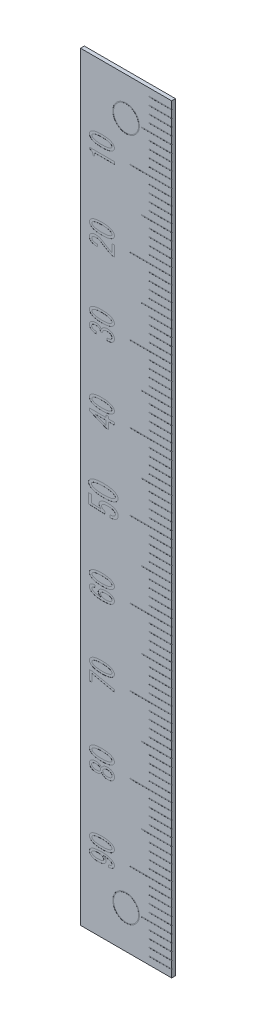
SolidWorks part; units mm, degrees
ref_plane "Front" through (0, 0, 0) normal (0, 0, 1) x (1, 0, 0)
ref_plane "Top" through (0, 0, 0) normal (0, 1, 0) x (1, 0, 0)
ref_plane "Right" through (0, 0, 0) normal (1, 0, 0) x (0, 0, -1)
sketch "Sketch1" plane through (0, 0, 0) normal (0, 0, 1) x (1, 0, 0)
  line L1 (0, 0) -> (0, 100)
  line L2 (0, 0) -> (12, 0)
  line L3 (12, 0) -> (12, 100)
  line L4 (0, 100) -> (12, 100)
  dimension "D1" = 100
  dimension "D2" = 12
extrude "Extrude1" add sketch "Sketch1" along normal blind 0.5
sketch "Sketch2" plane through (0, 0, 0.5) normal (0, 0, 1) x (1, 0, 0)
  line L0 (0, 100) -> (0, 0) construction
  line L1 (0, 0) -> (12, 0) construction
  line L2 (12, 100) -> (0, 100) construction
  circle A0 centre (6, 5) radius 1.75
  circle A1 centre (6, 95) radius 1.75
  circle A2 centre (6, 5) radius 1.65
  circle A3 centre (6, 95) radius 1.65
  dimension "D1" = 6
  dimension "D2" = 6
  dimension "D3" = 5
  dimension "D4" = 5
  dimension "D5" = 3.5
  dimension "D6" = 3.5
  dimension "D7" = 0.1
extrude "Extrude2" cut sketch "Sketch2" against normal blind 0.01
sketch "Sketch3" plane through (0, 0, 0.5) normal (0, 0, 1) x (1, 0, 0)
  line L0 (12, 100) -> (0, 100) construction
  line L1 (1, 88.25) -> (4.5, 88.25) construction
  line L2 (1, 88.25) -> (1, 91.75) construction
  line L3 (1, 91.75) -> (4.5, 91.75) construction
  line L4 (4.5, 88.25) -> (4.5, 91.75) construction
  line L5 (0, 100) -> (0, 0) construction
  line L6 (4.5, 78.25) -> (4.5, 81.75) construction
  line L7 (4.5, 68.25) -> (4.5, 71.75) construction
  line L8 (4.5, 58.25) -> (4.5, 61.75) construction
  line L9 (5, 48.25) -> (5, 51.75) construction
  line L10 (4.5, 38.25) -> (4.5, 41.75) construction
  line L11 (4.5, 28.25) -> (4.5, 31.75) construction
  line L12 (4.5, 18.25) -> (4.5, 21.75) construction
  line L13 (4.5, 8.25) -> (4.5, 11.75) construction
  line L14 (12, 0) -> (12, 100) construction
  text T0 "10" font "ＭＳ ゴシック" height in points 11
  text T1 "20" font "ＭＳ ゴシック" height in points 11
  text T2 "30" font "ＭＳ ゴシック" height in points 11
  text T3 "40" font "ＭＳ ゴシック" height in points 11
  text T4 "50" font "ＭＳ ゴシック" height in points 13
  text T5 "60  " font "ＭＳ ゴシック" height in points 11
  text T6 "70" font "ＭＳ ゴシック" height in points 11
  text T7 "80" font "ＭＳ ゴシック" height in points 11
  text T8 "90" font "ＭＳ ゴシック" height in points 11
  point P4 (4.5, 90)
  point P34 (5, 50)
  dimension "D1" = 3.5
  dimension "D2" = 10
  dimension "D3" = 1
  dimension "D4" = 3.5
  dimension "D7" = 7
  dimension "D5" = 4
extrude "Extrude3" cut sketch "Sketch3" against normal blind 0.01
sketch "Sketch4" plane through (0, 0, 0.5) normal (0, 0, 1) x (1, 0, 0)
  line L0 (12, 90.05) -> (6.5, 90.05)
  line L1 (12, 0) -> (12, 100) construction
  line L2 (6.5, 90.05) -> (6.5, 89.95)
  line L3 (6.5, 89.95) -> (12, 89.95)
  line L4 (12, 89.95) -> (12, 90.05)
  line L5 (12, 100) -> (0, 100) construction
  line L6 (12, 98.05) -> (12, 97.95)
  line L7 (12, 94.95) -> (8, 94.95)
  line L8 (12, 94.95) -> (12, 95.05)
  line L9 (12, 95.05) -> (8, 95.05)
  line L10 (8, 94.95) -> (8, 95.05)
  line L11 (12, 99.05) -> (9, 99.05)
  line L12 (12, 99.05) -> (12, 98.95)
  line L13 (12, 98.95) -> (9, 98.95)
  line L14 (9, 99.05) -> (9, 98.95)
  line L15 (12, 98.05) -> (9, 98.05)
  line L16 (12, 97.95) -> (9, 97.95)
  line L17 (9, 98.05) -> (9, 97.95)
  line L18 (12, 97.05) -> (12, 96.95)
  line L19 (12, 97.05) -> (9, 97.05)
  line L20 (12, 96.95) -> (9, 96.95)
  line L21 (9, 97.05) -> (9, 96.95)
  line L22 (12, 96.05) -> (12, 95.95)
  line L23 (12, 96.05) -> (9, 96.05)
  line L24 (12, 95.95) -> (9, 95.95)
  line L25 (9, 96.05) -> (9, 95.95)
  line L26 (12, 80.05) -> (6.5, 80.05)
  line L27 (6.5, 80.05) -> (6.5, 79.95)
  line L28 (6.5, 79.95) -> (12, 79.95)
  line L29 (12, 79.95) -> (12, 80.05)
  line L30 (12, 94.05) -> (12, 93.95)
  line L31 (12, 94.05) -> (9, 94.05)
  line L32 (12, 93.95) -> (9, 93.95)
  line L33 (9, 94.05) -> (9, 93.95)
  line L34 (12, 93.05) -> (12, 92.95)
  line L35 (12, 93.05) -> (9, 93.05)
  line L36 (12, 92.95) -> (9, 92.95)
  line L37 (9, 93.05) -> (9, 92.95)
  line L38 (12, 92.05) -> (12, 91.95)
  line L39 (12, 92.05) -> (9, 92.05)
  line L40 (12, 91.95) -> (9, 91.95)
  line L41 (9, 92.05) -> (9, 91.95)
  line L42 (12, 91.05) -> (12, 90.95)
  line L43 (12, 91.05) -> (9, 91.05)
  line L44 (12, 90.95) -> (9, 90.95)
  line L45 (9, 91.05) -> (9, 90.95)
  line L46 (9, 95.05) -> (9, 94.95)
  line L47 (12, 95.05) -> (9, 95.05)
  line L48 (12, 94.95) -> (9, 94.95)
  line L49 (12, 95.05) -> (12, 94.95)
  line L50 (12, 88.05) -> (12, 87.95)
  line L51 (12, 84.95) -> (8, 84.95)
  line L52 (12, 84.95) -> (12, 85.05)
  line L53 (12, 85.05) -> (8, 85.05)
  line L54 (8, 84.95) -> (8, 85.05)
  line L55 (12, 89.05) -> (9, 89.05)
  line L56 (12, 89.05) -> (12, 88.95)
  line L57 (12, 88.95) -> (9, 88.95)
  line L58 (9, 89.05) -> (9, 88.95)
  line L59 (12, 88.05) -> (9, 88.05)
  line L60 (12, 87.95) -> (9, 87.95)
  line L61 (9, 88.05) -> (9, 87.95)
  line L62 (12, 87.05) -> (12, 86.95)
  line L63 (12, 87.05) -> (9, 87.05)
  line L64 (12, 86.95) -> (9, 86.95)
  line L65 (9, 87.05) -> (9, 86.95)
  line L66 (12, 86.05) -> (12, 85.95)
  line L67 (12, 86.05) -> (9, 86.05)
  line L68 (12, 85.95) -> (9, 85.95)
  line L69 (9, 86.05) -> (9, 85.95)
  line L70 (12, 84.05) -> (12, 83.95)
  line L71 (12, 84.05) -> (9, 84.05)
  line L72 (12, 83.95) -> (9, 83.95)
  line L73 (9, 84.05) -> (9, 83.95)
  line L74 (12, 83.05) -> (12, 82.95)
  line L75 (12, 83.05) -> (9, 83.05)
  line L76 (12, 82.95) -> (9, 82.95)
  line L77 (9, 83.05) -> (9, 82.95)
  line L78 (12, 82.05) -> (12, 81.95)
  line L79 (12, 82.05) -> (9, 82.05)
  line L80 (12, 81.95) -> (9, 81.95)
  line L81 (9, 82.05) -> (9, 81.95)
  line L82 (12, 81.05) -> (12, 80.95)
  line L83 (12, 81.05) -> (9, 81.05)
  line L84 (12, 80.95) -> (9, 80.95)
  line L85 (9, 81.05) -> (9, 80.95)
  line L86 (12, 70.05) -> (6.5, 70.05)
  line L87 (6.5, 70.05) -> (6.5, 69.95)
  line L88 (6.5, 69.95) -> (12, 69.95)
  line L89 (12, 69.95) -> (12, 70.05)
  line L90 (12, 78.05) -> (12, 77.95)
  line L91 (12, 74.95) -> (8, 74.95)
  line L92 (12, 74.95) -> (12, 75.05)
  line L93 (12, 75.05) -> (8, 75.05)
  line L94 (8, 74.95) -> (8, 75.05)
  line L95 (12, 79.05) -> (9, 79.05)
  line L96 (12, 79.05) -> (12, 78.95)
  line L97 (12, 78.95) -> (9, 78.95)
  line L98 (9, 79.05) -> (9, 78.95)
  line L99 (12, 78.05) -> (9, 78.05)
  line L100 (12, 77.95) -> (9, 77.95)
  line L101 (9, 78.05) -> (9, 77.95)
  line L102 (12, 77.05) -> (12, 76.95)
  line L103 (12, 77.05) -> (9, 77.05)
  line L104 (12, 76.95) -> (9, 76.95)
  line L105 (9, 77.05) -> (9, 76.95)
  line L106 (12, 76.05) -> (12, 75.95)
  line L107 (12, 76.05) -> (9, 76.05)
  line L108 (12, 75.95) -> (9, 75.95)
  line L109 (9, 76.05) -> (9, 75.95)
  line L110 (12, 74.05) -> (12, 73.95)
  line L111 (12, 74.05) -> (9, 74.05)
  line L112 (12, 73.95) -> (9, 73.95)
  line L113 (9, 74.05) -> (9, 73.95)
  line L114 (12, 73.05) -> (12, 72.95)
  line L115 (12, 73.05) -> (9, 73.05)
  line L116 (12, 72.95) -> (9, 72.95)
  line L117 (9, 73.05) -> (9, 72.95)
  line L118 (12, 72.05) -> (12, 71.95)
  line L119 (12, 72.05) -> (9, 72.05)
  line L120 (12, 71.95) -> (9, 71.95)
  line L121 (9, 72.05) -> (9, 71.95)
  line L122 (12, 71.05) -> (12, 70.95)
  line L123 (12, 71.05) -> (9, 71.05)
  line L124 (12, 70.95) -> (9, 70.95)
  line L125 (9, 71.05) -> (9, 70.95)
  line L126 (12, 60.05) -> (6.5, 60.05)
  line L127 (6.5, 60.05) -> (6.5, 59.95)
  line L128 (6.5, 59.95) -> (12, 59.95)
  line L129 (12, 59.95) -> (12, 60.05)
  line L130 (12, 68.05) -> (12, 67.95)
  line L131 (12, 64.95) -> (8, 64.95)
  line L132 (12, 64.95) -> (12, 65.05)
  line L133 (12, 65.05) -> (8, 65.05)
  line L134 (8, 64.95) -> (8, 65.05)
  line L135 (12, 69.05) -> (9, 69.05)
  line L136 (12, 69.05) -> (12, 68.95)
  line L137 (12, 68.95) -> (9, 68.95)
  line L138 (9, 69.05) -> (9, 68.95)
  line L139 (12, 68.05) -> (9, 68.05)
  line L140 (12, 67.95) -> (9, 67.95)
  line L141 (9, 68.05) -> (9, 67.95)
  line L142 (12, 67.05) -> (12, 66.95)
  line L143 (12, 67.05) -> (9, 67.05)
  line L144 (12, 66.95) -> (9, 66.95)
  line L145 (9, 67.05) -> (9, 66.95)
  line L146 (12, 66.05) -> (12, 65.95)
  line L147 (12, 66.05) -> (9, 66.05)
  line L148 (12, 65.95) -> (9, 65.95)
  line L149 (9, 66.05) -> (9, 65.95)
  line L150 (12, 64.05) -> (12, 63.95)
  line L151 (12, 64.05) -> (9, 64.05)
  line L152 (12, 63.95) -> (9, 63.95)
  line L153 (9, 64.05) -> (9, 63.95)
  line L154 (12, 63.05) -> (12, 62.95)
  line L155 (12, 63.05) -> (9, 63.05)
  line L156 (12, 62.95) -> (9, 62.95)
  line L157 (9, 63.05) -> (9, 62.95)
  line L158 (12, 62.05) -> (12, 61.95)
  line L159 (12, 62.05) -> (9, 62.05)
  line L160 (12, 61.95) -> (9, 61.95)
  line L161 (9, 62.05) -> (9, 61.95)
  line L162 (12, 61.05) -> (12, 60.95)
  line L163 (12, 61.05) -> (9, 61.05)
  line L164 (12, 60.95) -> (9, 60.95)
  line L165 (9, 61.05) -> (9, 60.95)
  line L166 (12, 50.05) -> (6.5, 50.05)
  line L167 (6.5, 50.05) -> (6.5, 49.95)
  line L168 (6.5, 49.95) -> (12, 49.95)
  line L169 (12, 49.95) -> (12, 50.05)
  line L170 (12, 58.05) -> (12, 57.95)
  line L171 (12, 54.95) -> (8, 54.95)
  line L172 (12, 54.95) -> (12, 55.05)
  line L173 (12, 55.05) -> (8, 55.05)
  line L174 (8, 54.95) -> (8, 55.05)
  line L175 (12, 59.05) -> (9, 59.05)
  line L176 (12, 59.05) -> (12, 58.95)
  line L177 (12, 58.95) -> (9, 58.95)
  line L178 (9, 59.05) -> (9, 58.95)
  line L179 (12, 58.05) -> (9, 58.05)
  line L180 (12, 57.95) -> (9, 57.95)
  line L181 (9, 58.05) -> (9, 57.95)
  line L182 (12, 57.05) -> (12, 56.95)
  line L183 (12, 57.05) -> (9, 57.05)
  line L184 (12, 56.95) -> (9, 56.95)
  line L185 (9, 57.05) -> (9, 56.95)
  line L186 (12, 56.05) -> (12, 55.95)
  line L187 (12, 56.05) -> (9, 56.05)
  line L188 (12, 55.95) -> (9, 55.95)
  line L189 (9, 56.05) -> (9, 55.95)
  line L190 (12, 54.05) -> (12, 53.95)
  line L191 (12, 54.05) -> (9, 54.05)
  line L192 (12, 53.95) -> (9, 53.95)
  line L193 (9, 54.05) -> (9, 53.95)
  line L194 (12, 53.05) -> (12, 52.95)
  line L195 (12, 53.05) -> (9, 53.05)
  line L196 (12, 52.95) -> (9, 52.95)
  line L197 (9, 53.05) -> (9, 52.95)
  line L198 (12, 52.05) -> (12, 51.95)
  line L199 (12, 52.05) -> (9, 52.05)
  line L200 (12, 51.95) -> (9, 51.95)
  line L201 (9, 52.05) -> (9, 51.95)
  line L202 (12, 51.05) -> (12, 50.95)
  line L203 (12, 51.05) -> (9, 51.05)
  line L204 (12, 50.95) -> (9, 50.95)
  line L205 (9, 51.05) -> (9, 50.95)
  line L206 (12, 50.05) -> (6.5, 50.05)
  line L207 (6.5, 50.05) -> (6.5, 49.95)
  line L208 (6.5, 49.95) -> (12, 49.95)
  line L209 (12, 49.95) -> (12, 50.05)
  line L210 (12, 48.05) -> (12, 47.95)
  line L211 (12, 44.95) -> (8, 44.95)
  line L212 (12, 44.95) -> (12, 45.05)
  line L213 (12, 45.05) -> (8, 45.05)
  line L214 (8, 44.95) -> (8, 45.05)
  line L215 (12, 49.05) -> (9, 49.05)
  line L216 (12, 49.05) -> (12, 48.95)
  line L217 (12, 48.95) -> (9, 48.95)
  line L218 (9, 49.05) -> (9, 48.95)
  line L219 (12, 48.05) -> (9, 48.05)
  line L220 (12, 47.95) -> (9, 47.95)
  line L221 (9, 48.05) -> (9, 47.95)
  line L222 (12, 47.05) -> (12, 46.95)
  line L223 (12, 47.05) -> (9, 47.05)
  line L224 (12, 46.95) -> (9, 46.95)
  line L225 (9, 47.05) -> (9, 46.95)
  line L226 (12, 46.05) -> (12, 45.95)
  line L227 (12, 46.05) -> (9, 46.05)
  line L228 (12, 45.95) -> (9, 45.95)
  line L229 (9, 46.05) -> (9, 45.95)
  line L230 (12, 44.05) -> (12, 43.95)
  line L231 (12, 44.05) -> (9, 44.05)
  line L232 (12, 43.95) -> (9, 43.95)
  line L233 (9, 44.05) -> (9, 43.95)
  line L234 (12, 43.05) -> (12, 42.95)
  line L235 (12, 43.05) -> (9, 43.05)
  line L236 (12, 42.95) -> (9, 42.95)
  line L237 (9, 43.05) -> (9, 42.95)
  line L238 (12, 42.05) -> (12, 41.95)
  line L239 (12, 42.05) -> (9, 42.05)
  line L240 (12, 41.95) -> (9, 41.95)
  line L241 (9, 42.05) -> (9, 41.95)
  line L242 (12, 41.05) -> (12, 40.95)
  line L243 (12, 41.05) -> (9, 41.05)
  line L244 (12, 40.95) -> (9, 40.95)
  line L245 (9, 41.05) -> (9, 40.95)
  line L246 (12, 40.05) -> (6.5, 40.05)
  line L247 (6.5, 40.05) -> (6.5, 39.95)
  line L248 (6.5, 39.95) -> (12, 39.95)
  line L249 (12, 39.95) -> (12, 40.05)
  line L250 (12, 38.05) -> (12, 37.95)
  line L251 (12, 34.95) -> (8, 34.95)
  line L252 (12, 34.95) -> (12, 35.05)
  line L253 (12, 35.05) -> (8, 35.05)
  line L254 (8, 34.95) -> (8, 35.05)
  line L255 (12, 39.05) -> (9, 39.05)
  line L256 (12, 39.05) -> (12, 38.95)
  line L257 (12, 38.95) -> (9, 38.95)
  line L258 (9, 39.05) -> (9, 38.95)
  line L259 (12, 38.05) -> (9, 38.05)
  line L260 (12, 37.95) -> (9, 37.95)
  line L261 (9, 38.05) -> (9, 37.95)
  line L262 (12, 37.05) -> (12, 36.95)
  line L263 (12, 37.05) -> (9, 37.05)
  line L264 (12, 36.95) -> (9, 36.95)
  line L265 (9, 37.05) -> (9, 36.95)
  line L266 (12, 36.05) -> (12, 35.95)
  line L267 (12, 36.05) -> (9, 36.05)
  line L268 (12, 35.95) -> (9, 35.95)
  line L269 (9, 36.05) -> (9, 35.95)
  line L270 (12, 34.05) -> (12, 33.95)
  line L271 (12, 34.05) -> (9, 34.05)
  line L272 (12, 33.95) -> (9, 33.95)
  line L273 (9, 34.05) -> (9, 33.95)
  line L274 (12, 33.05) -> (12, 32.95)
  line L275 (12, 33.05) -> (9, 33.05)
  line L276 (12, 32.95) -> (9, 32.95)
  line L277 (9, 33.05) -> (9, 32.95)
  line L278 (12, 32.05) -> (12, 31.95)
  line L279 (12, 32.05) -> (9, 32.05)
  line L280 (12, 31.95) -> (9, 31.95)
  line L281 (9, 32.05) -> (9, 31.95)
  line L282 (12, 31.05) -> (12, 30.95)
  line L283 (12, 31.05) -> (9, 31.05)
  line L284 (12, 30.95) -> (9, 30.95)
  line L285 (9, 31.05) -> (9, 30.95)
  line L286 (12, 30.05) -> (6.5, 30.05)
  line L287 (6.5, 30.05) -> (6.5, 29.95)
  line L288 (6.5, 29.95) -> (12, 29.95)
  line L289 (12, 29.95) -> (12, 30.05)
  line L290 (12, 28.05) -> (12, 27.95)
  line L291 (12, 24.95) -> (8, 24.95)
  line L292 (12, 24.95) -> (12, 25.05)
  line L293 (12, 25.05) -> (8, 25.05)
  line L294 (8, 24.95) -> (8, 25.05)
  line L295 (12, 29.05) -> (9, 29.05)
  line L296 (12, 29.05) -> (12, 28.95)
  line L297 (12, 28.95) -> (9, 28.95)
  line L298 (9, 29.05) -> (9, 28.95)
  line L299 (12, 28.05) -> (9, 28.05)
  line L300 (12, 27.95) -> (9, 27.95)
  line L301 (9, 28.05) -> (9, 27.95)
  line L302 (12, 27.05) -> (12, 26.95)
  line L303 (12, 27.05) -> (9, 27.05)
  line L304 (12, 26.95) -> (9, 26.95)
  line L305 (9, 27.05) -> (9, 26.95)
  line L306 (12, 26.05) -> (12, 25.95)
  line L307 (12, 26.05) -> (9, 26.05)
  line L308 (12, 25.95) -> (9, 25.95)
  line L309 (9, 26.05) -> (9, 25.95)
  line L310 (12, 24.05) -> (12, 23.95)
  line L311 (12, 24.05) -> (9, 24.05)
  line L312 (12, 23.95) -> (9, 23.95)
  line L313 (9, 24.05) -> (9, 23.95)
  line L314 (12, 23.05) -> (12, 22.95)
  line L315 (12, 23.05) -> (9, 23.05)
  line L316 (12, 22.95) -> (9, 22.95)
  line L317 (9, 23.05) -> (9, 22.95)
  line L318 (12, 22.05) -> (12, 21.95)
  line L319 (12, 22.05) -> (9, 22.05)
  line L320 (12, 21.95) -> (9, 21.95)
  line L321 (9, 22.05) -> (9, 21.95)
  line L322 (12, 21.05) -> (12, 20.95)
  line L323 (12, 21.05) -> (9, 21.05)
  line L324 (12, 20.95) -> (9, 20.95)
  line L325 (9, 21.05) -> (9, 20.95)
  line L326 (12, 20.05) -> (6.5, 20.05)
  line L327 (6.5, 20.05) -> (6.5, 19.95)
  line L328 (6.5, 19.95) -> (12, 19.95)
  line L329 (12, 19.95) -> (12, 20.05)
  line L330 (12, 18.05) -> (12, 17.95)
  line L331 (12, 14.95) -> (8, 14.95)
  line L332 (12, 14.95) -> (12, 15.05)
  line L333 (12, 15.05) -> (8, 15.05)
  line L334 (8, 14.95) -> (8, 15.05)
  line L335 (12, 19.05) -> (9, 19.05)
  line L336 (12, 19.05) -> (12, 18.95)
  line L337 (12, 18.95) -> (9, 18.95)
  line L338 (9, 19.05) -> (9, 18.95)
  line L339 (12, 18.05) -> (9, 18.05)
  line L340 (12, 17.95) -> (9, 17.95)
  line L341 (9, 18.05) -> (9, 17.95)
  line L342 (12, 17.05) -> (12, 16.95)
  line L343 (12, 17.05) -> (9, 17.05)
  line L344 (12, 16.95) -> (9, 16.95)
  line L345 (9, 17.05) -> (9, 16.95)
  line L346 (12, 16.05) -> (12, 15.95)
  line L347 (12, 16.05) -> (9, 16.05)
  line L348 (12, 15.95) -> (9, 15.95)
  line L349 (9, 16.05) -> (9, 15.95)
  line L350 (12, 14.05) -> (12, 13.95)
  line L351 (12, 14.05) -> (9, 14.05)
  line L352 (12, 13.95) -> (9, 13.95)
  line L353 (9, 14.05) -> (9, 13.95)
  line L354 (12, 13.05) -> (12, 12.95)
  line L355 (12, 13.05) -> (9, 13.05)
  line L356 (12, 12.95) -> (9, 12.95)
  line L357 (9, 13.05) -> (9, 12.95)
  line L358 (12, 12.05) -> (12, 11.95)
  line L359 (12, 12.05) -> (9, 12.05)
  line L360 (12, 11.95) -> (9, 11.95)
  line L361 (9, 12.05) -> (9, 11.95)
  line L362 (12, 11.05) -> (12, 10.95)
  line L363 (12, 11.05) -> (9, 11.05)
  line L364 (12, 10.95) -> (9, 10.95)
  line L365 (9, 11.05) -> (9, 10.95)
  line L366 (12, 10.05) -> (6.5, 10.05)
  line L367 (6.5, 10.05) -> (6.5, 9.95)
  line L368 (6.5, 9.95) -> (12, 9.95)
  line L369 (12, 9.95) -> (12, 10.05)
  line L370 (12, 8.05) -> (12, 7.95)
  line L371 (12, 4.95) -> (8, 4.95)
  line L372 (12, 4.95) -> (12, 5.05)
  line L373 (12, 5.05) -> (8, 5.05)
  line L374 (8, 4.95) -> (8, 5.05)
  line L375 (12, 9.05) -> (9, 9.05)
  line L376 (12, 9.05) -> (12, 8.95)
  line L377 (12, 8.95) -> (9, 8.95)
  line L378 (9, 9.05) -> (9, 8.95)
  line L379 (12, 8.05) -> (9, 8.05)
  line L380 (12, 7.95) -> (9, 7.95)
  line L381 (9, 8.05) -> (9, 7.95)
  line L382 (12, 7.05) -> (12, 6.95)
  line L383 (12, 7.05) -> (9, 7.05)
  line L384 (12, 6.95) -> (9, 6.95)
  line L385 (9, 7.05) -> (9, 6.95)
  line L386 (12, 6.05) -> (12, 5.95)
  line L387 (12, 6.05) -> (9, 6.05)
  line L388 (12, 5.95) -> (9, 5.95)
  line L389 (9, 6.05) -> (9, 5.95)
  line L390 (12, 4.05) -> (12, 3.95)
  line L391 (12, 4.05) -> (9, 4.05)
  line L392 (12, 3.95) -> (9, 3.95)
  line L393 (9, 4.05) -> (9, 3.95)
  line L394 (12, 3.05) -> (12, 2.95)
  line L395 (12, 3.05) -> (9, 3.05)
  line L396 (12, 2.95) -> (9, 2.95)
  line L397 (9, 3.05) -> (9, 2.95)
  line L398 (12, 2.05) -> (12, 1.95)
  line L399 (12, 2.05) -> (9, 2.05)
  line L400 (12, 1.95) -> (9, 1.95)
  line L401 (9, 2.05) -> (9, 1.95)
  line L402 (12, 1.05) -> (12, 0.95)
  line L403 (12, 1.05) -> (9, 1.05)
  line L404 (12, 0.95) -> (9, 0.95)
  line L405 (9, 1.05) -> (9, 0.95)
  point P4 (12, 90)
  point P13 (12, 95)
  point P18 (12, 99)
  dimension "D1" = 10
  dimension "D2" = 0.1
  dimension "D3" = 5.5
  dimension "D4" = 5
  dimension "D5" = 0.1
  dimension "D6" = 1
  dimension "D7" = 0.1
  dimension "D8" = 3
  dimension "D9" = 4
  dimension "D10" = 9
  dimension "D11" = 5
  dimension "D12" = 6
extrude "Extrude4" cut sketch "Sketch4" against normal blind 0.01
move or copy body "Body-Move/Copy2" bodies to move or copy 105 copy no translate (-12, -50, 0)
move or copy body "Body-Move/Copy3" bodies to move or copy 107 copy no translate (0, -50, 0)
